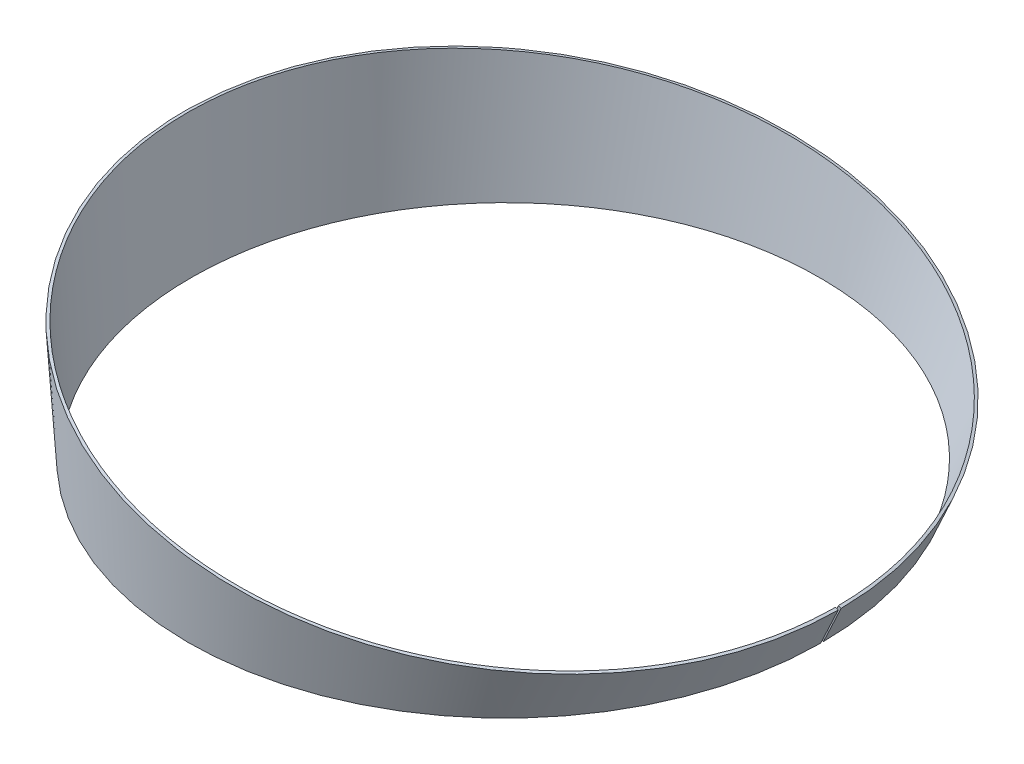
SolidWorks part; units mm, degrees
ref_plane "Ebene vorne" through (0, 0, 0) normal (0, 0, 1) x (1, 0, 0)
ref_plane "Ebene oben" through (0, 0, 0) normal (0, 1, 0) x (1, 0, 0)
ref_plane "Ebene rechts" through (0, 0, 0) normal (1, 0, 0) x (0, 0, -1)
sketch "Skizze1" plane through (0, 0, 0) normal (0, 0, 1) x (1, 0, 0)
  line L0 (0, 0) -> (40, 0) construction
  line L1 (40, 0) -> (0.4925, 6.2574) construction
  arc A0 (0.4925, 6.2574) -> (0, 0) centre (40, 0) ccw
  dimension "D1" = 9
  dimension "D2" = 40
ref_plane "Ebene1" through (0.4925, 6.2574, 0) normal (-0.1564, -0.9877, 0) x (0.9877, -0.1564, 0)
sketch "Skizze2" plane through (0, 0, 0) normal (0, 1, 0) x (1, 0, 0)
  line L0 (22.1848, 0.0968) -> (0, 0) construction
  line L1 (0, 0) -> (22.1848, -0.0968) construction
  line L2 (22.1848, -0.0968) -> (22.1848, 0.0968) construction
  arc A0 (22.1848, 0.0968) -> (22.1848, -0.0968) centre (0, 0) ccw
  dimension "D1" = 44.37
  dimension "D2" = 0.5
sketch "Skizze3" plane through (0.4925, 6.2574, 0) normal (-0.1564, -0.9877, 0) x (0.9877, -0.1564, 0)
  line L0 (23.2098, -0.1013) -> (0, 0) construction
  line L1 (0, 0) -> (23.2098, 0.1013) construction
  line L2 (23.2098, 0.1013) -> (23.2098, -0.1013) construction
  arc A0 (23.2098, 0.1013) -> (23.2098, -0.1013) centre (0, 0) ccw
  dimension "D1" = 46.42
  dimension "D2" = 0.5
sheet metal parameters "Blech1" thickness 0.2 parameters "D1"=2, "Dicke"=0.2
lofted bend "Ausgeformte Biegungen1" parameters "D1"=0, "D12"=0.2
other "Freiform-Biegung1" parameters "D1"=1000, "D4"=57.296, "D5"=1
flat pattern "Abwicklung1"
sketch "Biegung-Linien1" plane through (0, 0, 0) normal (0, 1, 0) x (-1, 0, 0)
other "Abwickeln-<Freiform-Biegung1>1"
